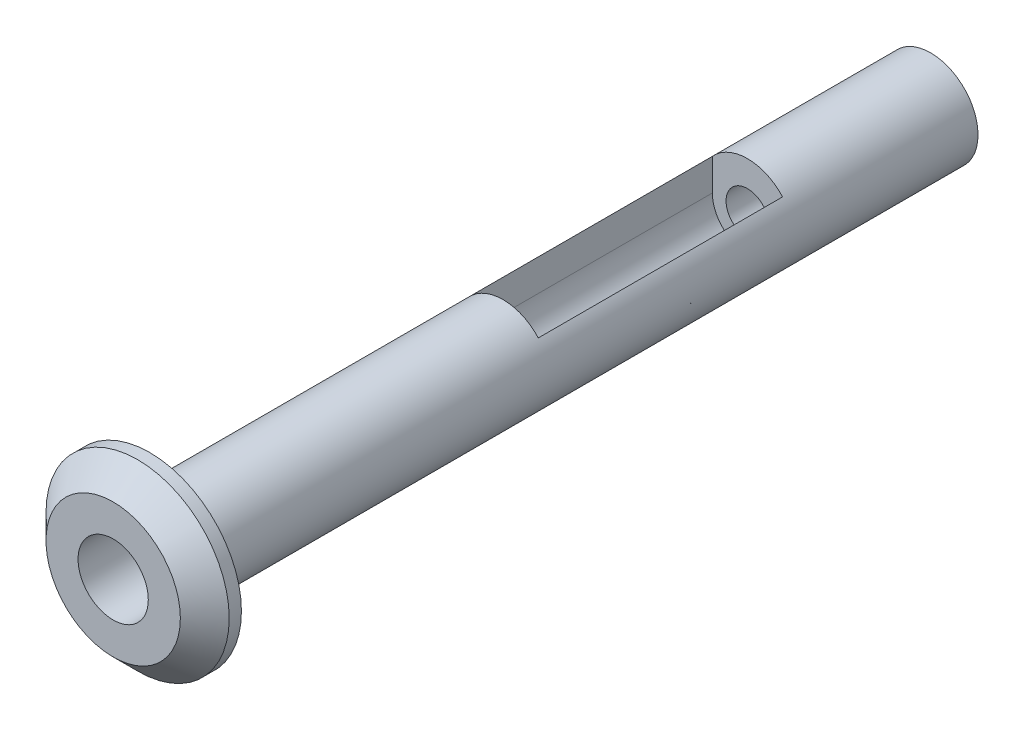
SolidWorks part; units mm, degrees
ref_plane "Alzado" through (0, 0, 0) normal (0, 0, 1) x (1, 0, 0)
ref_plane "Planta" through (0, 0, 0) normal (0, 1, 0) x (1, 0, 0)
ref_plane "Vista lateral" through (0, 0, 0) normal (1, 0, 0) x (0, 0, -1)
sketch "Croquis1" plane through (0, 0, 0) normal (0, 0, 1) x (1, 0, 0)
  circle A0 centre (0, 0) radius 7.5
  circle A1 centre (0, 0) radius 1.75
  dimension "D1" = 15
  dimension "D2" = 3.5
extrude "Saliente-Extruir1" add sketch "Croquis1" along normal mid plane 3
chamfer "Chaflán1" distance 2 angle 45 1 edges at (7.5, 0, 1.5)
sketch "Croquis2" plane through (0, 0, -1.5) normal (0, 0, -1) x (-1, 0, 0)
  circle A2 centre (0, 0) radius 1.75 construction
  circle A3 centre (0, 0) radius 1.75
  circle A4 centre (0, 0) radius 3.875
  dimension "D1" = 7.75
extrude "Saliente-Extruir2" add sketch "Croquis2" along normal blind 63.93
sketch "Croquis3" plane through (0, 0, 1.5) normal (0, 0, 1) x (1, 0, 0)
  circle A0 centre (0, 0) radius 2.875
  dimension "D1" = 5.75
extrude "Cortar-Extruir1" cut sketch "Croquis3" against normal offset from surface (51.93 mm away) 15
sketch "Croquis4" plane through (0, 0, -50.43) normal (0, 0, 1) x (1, 0, 0)
  line L0 (-2.875, 2.5981) -> (-2.875, 0)
  line L1 (-2.875, 0) -> (2.875, 0)
  line L2 (2.875, 0) -> (2.875, 2.5981)
  circle A0 centre (0, 0) radius 3.875 construction
  arc A1 (2.875, 2.5981) -> (-2.875, 2.5981) centre (0, 0) ccw
  circle A2 centre (0, 0) radius 2.875 construction
  arc A3 (-2.875, 2.5981) -> (2.875, 2.5981) centre (0, 0) ccw construction
extrude "Cortar-Extruir2" cut sketch "Croquis4" along normal blind 20
